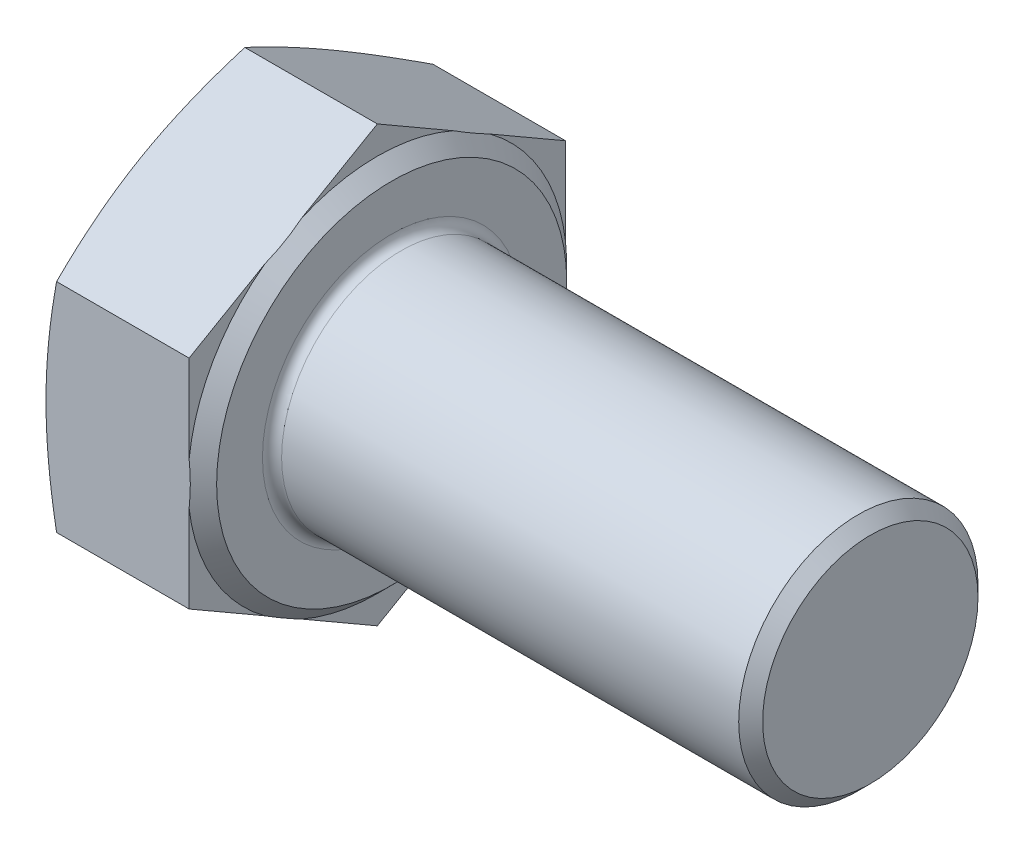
SolidWorks part; units mm, degrees
ref_plane "Front" through (0, 0, 0) normal (0, 0, 1) x (1, 0, 0)
ref_plane "Top" through (0, 0, 0) normal (0, 1, 0) x (1, 0, 0)
ref_plane "Right" through (0, 0, 0) normal (1, 0, 0) x (0, 0, -1)
sketch "Sketch2" plane through (0, 0, 0) normal (1, 0, 0) x (0, 0, -1)
  line L1 (7.865, -4.5409) -> (7.865, 4.5409)
  line L2 (7.865, 4.5409) -> (0, 9.0817)
  line L3 (0, 9.0817) -> (-7.865, 4.5409)
  line L4 (-7.865, 4.5409) -> (-7.865, -4.5409)
  line L5 (-7.865, -4.5409) -> (0, -9.0817)
  line L6 (0, -9.0817) -> (7.865, -4.5409)
  circle A0 centre (0, 0) radius 7.865 construction
  dimension "s" = 15.73
extrude "BaseHead" add sketch "Sketch2" along normal blind 6.58
sketch "Sketch3" plane through (0, 0, 0) normal (0, 0, 1) x (1, 0, 0)
  line L0 (6.58, 9.0817) -> (6.58, 7.315)
  line L2 (6.58, 7.315) -> (5.98, 7.915)
  line L3 (5.98, 7.915) -> (5.98, 9.0817)
  line L5 (5.98, 9.0817) -> (6.58, 9.0817)
  line L6 (-0.9571, 0) -> (7.6478, 0) construction
  line L7 (6.58, 9.0817) -> (0, 9.0817) construction
  dimension "D1" = 45
  dimension "c" = 0.6
  dimension "dw" = 14.63
revolve "BearingFace" cut sketch "Sketch3" angle 360 about L6
sketch "Sketch4" plane through (0, 0, 0) normal (0, 0, 1) x (1, 0, 0)
  line L0 (-0.4935, 0) -> (3.5626, 0) construction
  line L2 (0, 9.0817) -> (0.4428, 9.0817)
  line L4 (0.4428, 9.0817) -> (0, 7.865)
  line L6 (0, 7.865) -> (0, 9.0817)
  line L7 (5.98, 9.0817) -> (0, 9.0817) construction
  dimension "D1" = 20
  dimension "D2" = 15.73
revolve "HeadChamfer" cut sketch "Sketch4" angle 360 about L0
sketch "Sketch5" plane through (6.58, 0, 0) normal (1, 0, 0) x (0, 0, -1)
  circle A0 centre (0, 0) radius 5
  dimension "d" = 10
extrude "BaseBody" add sketch "Sketch5" along normal blind 20
chamfer "Chamfer1" distance 0.5 angle 45 1 edges at (26.58, 0, -5)
fillet "HeadFillet" radius 0.4 1 edges at (6.58, 0, 5)
equation "\"D2@Sketch4\" = \"s@Sketch2\""
equation "\"D1@Chamfer1\" = 0.05 * \"d@Sketch5\""
